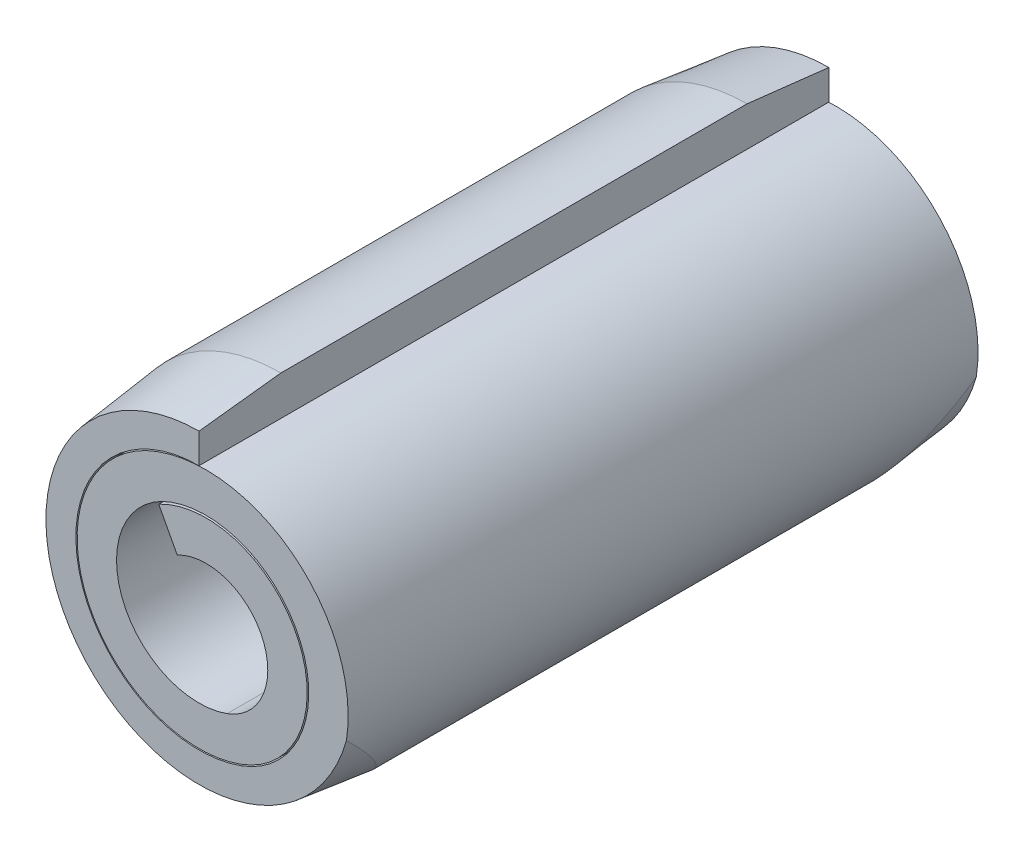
SolidWorks part; units mm, degrees
ref_plane "Front Plane" through (0, 0, 0) normal (0, 0, 1) x (1, 0, 0)
ref_plane "Top Plane" through (0, 0, 0) normal (0, 1, 0) x (1, 0, 0)
ref_plane "Right Plane" through (0, 0, 0) normal (1, 0, 0) x (0, 0, -1)
sketch "Sketch1" plane through (0, 0, 0) normal (0, 0, 1) x (1, 0, 0)
  line L0 (0, 0) -> (0, 3.2766) construction
  line L1 (0, 0.8192) -> (0, 1.6383) construction
  line L2 (0, 1.6383) -> (0, 2.4574) construction
  line L3 (0, 0.8192) -> (0, 0) construction
  line L4 (0, -0.8192) -> (0, 0) construction
  line L5 (0, -0.8192) -> (0, -1.6383) construction
  line L6 (0, -1.6383) -> (0, -2.4574) construction
  line L7 (0, 0) -> (-1.1207, 3.079) construction
  line L8 (0, 0) -> (1.1207, -3.079) construction
  circle A0 centre (0, 0) radius 3.2766
  point P0 (0, -0.8192)
  point P3 (0, 0.8192)
  point P5 (0, 1.6383)
  point P6 (0, 2.4574)
  point P9 (0, -1.6383)
  point P12 (0, -2.4574)
sketch "Sketch2" plane through (0, 0, 0) normal (0, 0, 1) x (1, 0, 0)
  line L0 (0, 0) -> (-1.1207, 3.079) construction
  line L1 (0, 0) -> (0, 3.2766) construction
  line L2 (0, 0) -> (1.1207, -3.079) construction
  line L3 (0, 0) -> (-1.6383, 2.8376) construction
  arc A0 (0, 3.2766) -> (1.1207, -3.079) centre (0, 0) ccw
  arc A2 (1.1207, -3.079) -> (-0.8405, 2.3092) centre (0.1401, -0.3849) ccw
  arc A3 (-0.8405, 2.3092) -> (0.8405, -2.3092) centre (0, 0) ccw
  arc A4 (0.8405, -2.3092) -> (-0.8116, 1.4057) centre (0.1435, -0.3944) ccw
  circle A5 centre (0, 0) radius 3.2766 construction
  dimension "D1" = 20
  dimension "D2" = 10
extrude "Extrude-Thin1" add sketch "Sketch2" against normal mid plane 12.7 thin
sketch "Sketch3" plane through (0, 0, 0) normal (1, 0, 0) x (0, 0, -1)
  line L0 (-6.35, 3.2766) -> (-6.35, 3.0861)
  line L1 (-6.35, 3.0861) -> (-4.699, 3.2766)
  line L2 (-4.699, 3.2766) -> (-6.35, 3.2766)
  line L3 (0, 0) -> (-6.35, 0) construction
  line L4 (-6.35, 2.4822) -> (-6.35, -3.079) construction
  line L5 (-4.699, -3.2766) -> (-6.35, -3.2766) construction
  line L6 (-6.35, -3.0861) -> (-4.699, -3.2766) construction
  line L7 (-6.35, -3.2766) -> (-6.35, -3.0861) construction
  line L8 (0, 0) -> (0, 3.2766) construction
  line L9 (6.35, 3.2766) -> (-6.35, 3.2766) construction
  line L10 (4.699, 3.2766) -> (6.35, 3.2766)
  line L11 (6.35, 3.0861) -> (4.699, 3.2766)
  line L12 (6.35, 3.2766) -> (6.35, 3.0861)
  dimension "Chamfer Lenght" = 1.651
  dimension "B" = 6.1722
revolve "Cut-Revolve1" cut sketch "Sketch3" angle 360 about L3
equation "\"D3@Sketch1\" = \"D2@Sketch1\"/4"
equation "\"D5@Extrude-Thin1\" = \"D3@Sketch1\"*.97"
